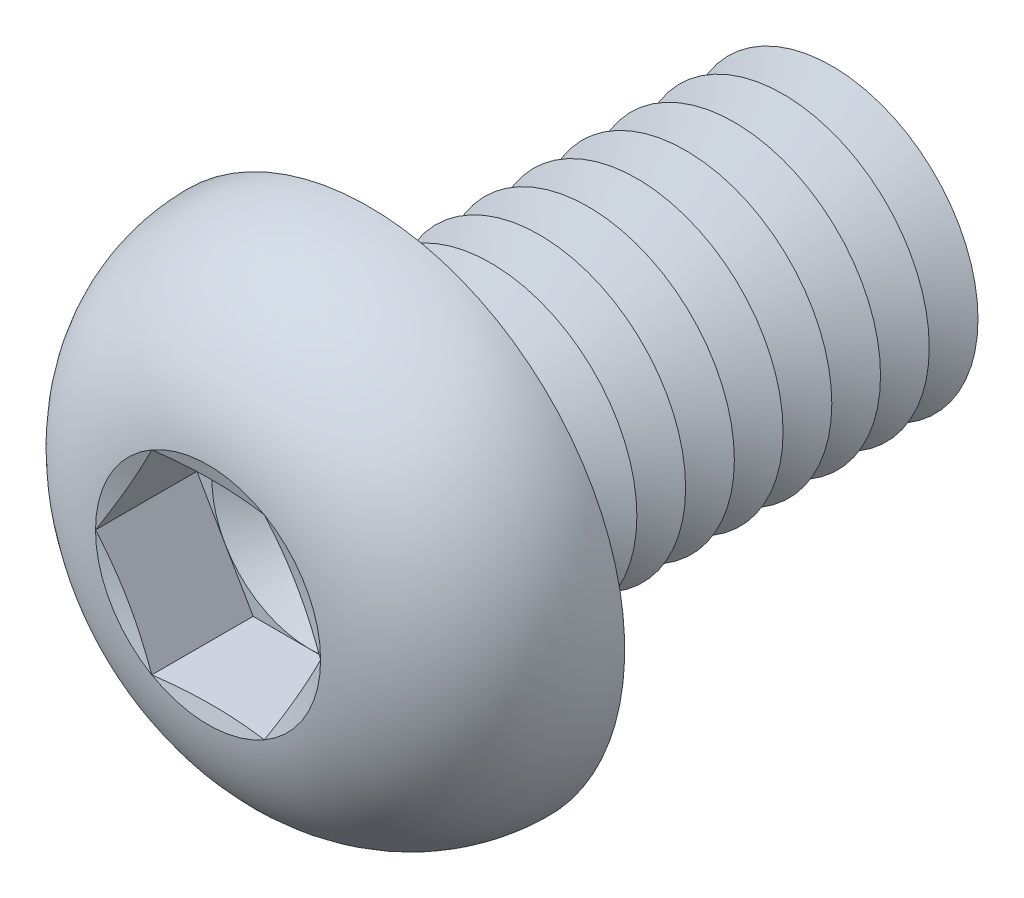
SolidWorks part; units mm, degrees
ref_plane "Front Plane" through (0, 0, 0) normal (0, 0, 1) x (1, 0, 0)
ref_plane "Top Plane" through (0, 0, 0) normal (0, 1, 0) x (1, 0, 0)
ref_plane "Right Plane" through (0, 0, 0) normal (1, 0, 0) x (0, 0, -1)
sketch "Sketch1" plane through (0, 0, 0) normal (1, 0, 0) x (0, 0, -1)
  line L0 (0, 3) -> (0, 5.25)
  line L3 (0, 3) -> (10, 3)
  line L4 (10, 3) -> (10, 0)
  line L5 (10, 0) -> (-3.3, 0) construction
  line L6 (-3.3, 0) -> (10, 0)
  line L7 (-3.3, 2.3094) -> (-3.3, 1.1547) construction
  line L8 (-3.3, 1.1547) -> (-3.3, 0)
  line L9 (-3.3, 2.3094) -> (-2.9906, 1.1547)
  line L10 (-2.9906, 1.1547) -> (-3.3, 1.1547)
  line L11 (10, 0) -> (22.7481, 0) construction
  line L12 (0, 5.25) -> (-3.3, 5.25) construction
  arc A1 (0, 5.25) -> (-3.3, 2.3094) centre (0, 1.928) ccw
  point P8 (10, 1.5)
  dimension "D1" = 10.5
  dimension "D2" = 6
  dimension "D3" = 3.3
  dimension "D4" = 4.6188
  dimension "D5" = 10
  dimension "D6" = 15
revolve "Revolve1" add sketch "Sketch1" angle 360 about L5
fillet "Fillet1" radius 0.5 1 edges at (-3, 0, 0)
sketch "Sketch2" plane through (0, 0, 0) normal (1, 0, 0) x (0, 0, -1)
  line L0 (9.5, 3) -> (10.5, 3)
  line L1 (10, 3) -> (0.5, 3) construction
  line L2 (10.5, 3) -> (10, 2.134)
  line L3 (10, -3) -> (10, 3) construction
  line L4 (10, 2.134) -> (9.5, 3)
  dimension "D1" = 1
revolve "Cut-Revolve1" cut sketch "Sketch2" angle 360 about axis through (0, 0, -10) along (0, 0, -1)
pattern_linear "LPattern1" count 10 spacing 1 along (0, 0, 1) of "Cut-Revolve1"
sketch "Sketch3" plane through (0, 0, 3.3) normal (0, 0, 1) x (1, 0, 0)
  line L7 (1.1547, 2) -> (-1.1547, 2)
  line L8 (-1.1547, 2) -> (-2.3094, 0)
  line L9 (-2.3094, 0) -> (-1.1547, -2)
  line L10 (-1.1547, -2) -> (1.1547, -2)
  line L11 (1.1547, -2) -> (2.3094, 0)
  line L12 (2.3094, 0) -> (1.1547, 2)
  circle A0 centre (0, 0) radius 2 construction
  circle A3 centre (0, 0) radius 2.3094 construction
extrude "Cut-Extrude1" cut sketch "Sketch3" against normal blind 2.08
sketch "Sketch4" plane through (0, 0, 1.22) normal (0, 0, 1) x (1, 0, 0)
  line L1 (1.1547, 2) -> (-1.1547, 2) construction
  circle A0 centre (0, 0) radius 2
extrude "Cut-Extrude2" cut sketch "Sketch4" against normal through all draft 60
